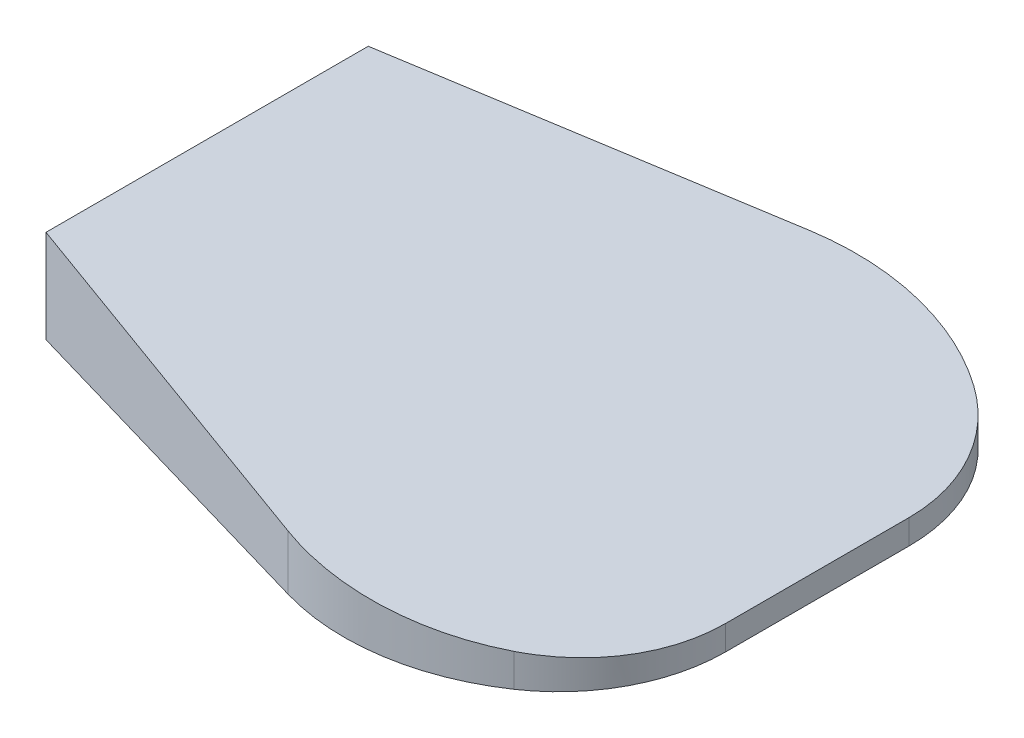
SolidWorks part; units mm, degrees
ref_plane "Front" through (0, 0, 0) normal (0, 0, 1) x (1, 0, 0)
ref_plane "Top" through (0, 0, 0) normal (0, 1, 0) x (1, 0, 0)
ref_plane "Right" through (0, 0, 0) normal (1, 0, 0) x (0, 0, -1)
sketch "Sketch1" plane through (0, 0, 0) normal (0, 1, 0) x (-1, 0, 0)
  line L0 (25.652, -50.3347) -> (25.652, 50.3347)
  line L1 (173.18, 143.1162) -> (360.8456, 88.5082)
  line L2 (360.8456, 88.5082) -> (360.8456, -88.5082)
  line L3 (-27.4722, 0) -> (346.1451, 0) construction
  line L4 (173.18, -143.1162) -> (360.8456, -88.5082)
  arc A0 (25.652, 50.3347) -> (66.0096, 126.3118) centre (117.3479, 50.3347) cw
  arc A1 (66.0096, 126.3118) -> (173.18, 143.1162) centre (137.5025, 20.5073) cw
  arc A4 (66.0096, -126.3118) -> (173.18, -143.1162) centre (137.5025, -20.5073) ccw
  arc A5 (25.652, -50.3347) -> (66.0096, -126.3118) centre (117.3479, -50.3347) ccw
  point P11 (0, 0)
sketch "Sketch2" plane through (0, 0, 0) normal (0, 0, 1) x (1, 0, 0)
  line L2 (-15.6752, 12.4273) -> (-445.9946, 60.6485)
extrude "Extrude1" add sketch "Sketch1" along normal blind 71
extrude "Cut-Extrude1" cut sketch "Sketch2" against normal through all and the other way through all flip side to cut
